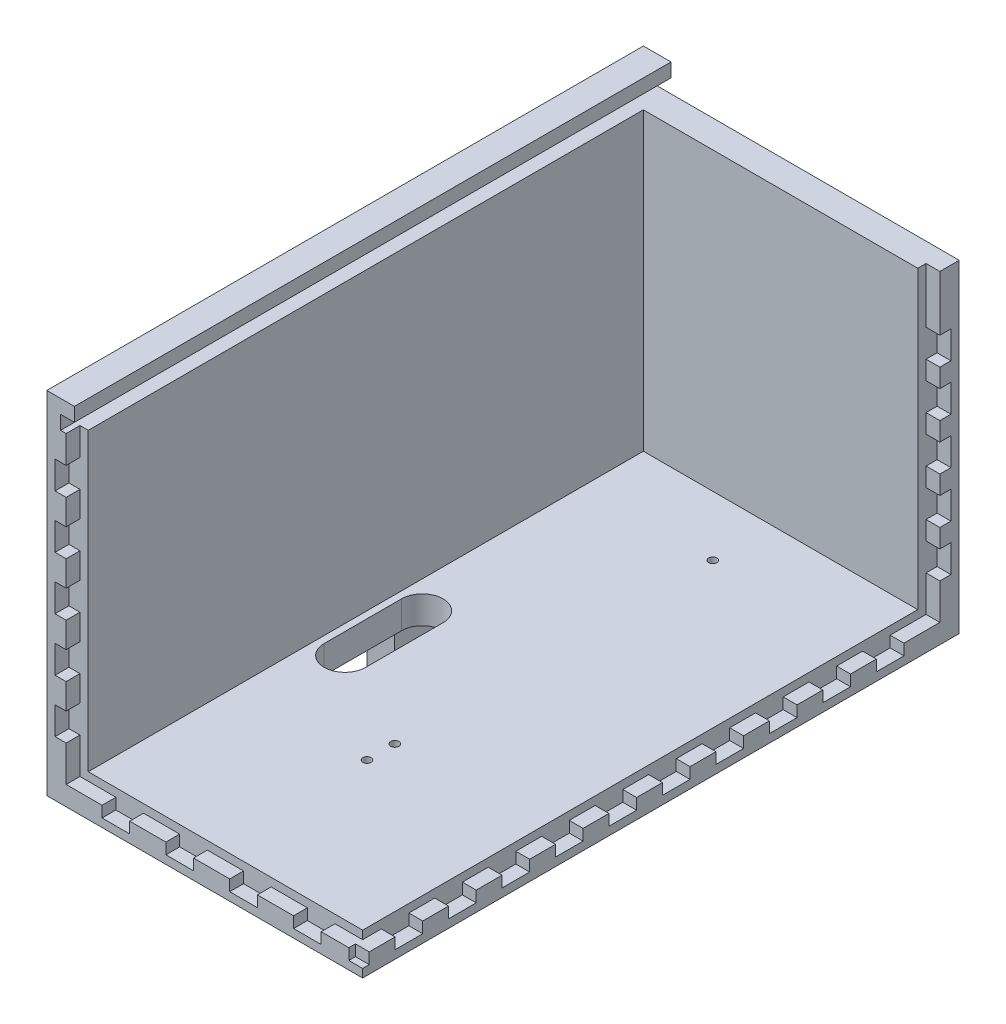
SolidWorks part; units mm, degrees
ref_plane "Front Plane" through (0, 0, 0) normal (0, 0, 1) x (1, 0, 0)
ref_plane "Top Plane" through (0, 0, 0) normal (0, 1, 0) x (1, 0, 0)
ref_plane "Right Plane" through (0, 0, 0) normal (1, 0, 0) x (0, 0, -1)
ref_plane "Metal_Det_Plane" through (0, 0, -5) normal (0, 0, -1) x (-1, 0, 0)
ref_plane "Center_Plane" through (0, 0, -215.9) normal (0, 0, -1) x (-1, 0, 0)
sketch "Centerline" plane through (0, 0, 0) normal (1, 0, 0) x (0, 0, -1)
  line L0 (-1000, 0) -> (49000, 0) construction
sketch "Sketch3" plane through (0, 0, 0) normal (1, 0, 0) x (0, 0, -1)
  line L3 (0, 0) -> (431.8, 0)
  line L4 (431.8, 0) -> (431.8, 127)
  line L5 (431.8, 127) -> (127, 127)
  line L6 (0, 0) -> (127, 127)
  point P3 (127, 0)
  point P4 (0, 0)
  dimension "D1" = 127
  dimension "D2" = 431.8
  dimension "D3" = 45
  dimension "D4" = 304.8
  dimension "D5" = 304.8
extrude "Boss-Extrude2" add sketch "Sketch3" along normal mid plane 228.6 contours L6 L5 L4 L3
shell "Shell2" thickness 10
sketch "Sketch4" plane through (0, 0, -431.8) normal (0, 0, -1) x (-1, 0, 0)
  line L0 (-104.3, 127) -> (-104.3, 122)
  line L1 (-114.3, 127) -> (114.3, 127) construction
  line L2 (-114.3, 127) -> (-114.3, 0) construction
  line L3 (-114.3, 0) -> (114.3, 0) construction
  line L4 (114.3, 127) -> (114.3, 0) construction
  line L5 (-114.3, 127) -> (114.3, 127) construction
  line L6 (-114.3, 127) -> (-114.3, 0) construction
  line L11 (-114.3, 0) -> (114.3, 0) construction
  line L13 (114.3, 127) -> (114.3, 0) construction
  line L14 (-114.3, 127) -> (114.3, 0) construction
  line L15 (-114.3, 0) -> (114.3, 127) construction
  line L16 (-104.3, 122) -> (-109.3, 122)
  line L17 (-109.3, 122) -> (-109.3, 117)
  line L18 (-109.3, 117) -> (-104.3, 117)
  line L19 (-104.3, 117) -> (-104.3, 10)
  line L20 (0, 0) -> (0, 127) construction
  line L21 (104.3, 10) -> (-104.3, 10)
  line L22 (104.3, 127) -> (104.3, 122)
  line L23 (104.3, 122) -> (109.3, 122)
  line L24 (109.3, 122) -> (109.3, 117)
  line L25 (109.3, 117) -> (104.3, 117)
  line L26 (104.3, 117) -> (104.3, 10)
  line L27 (-104.3, 117) -> (104.3, 117)
  line L28 (-104.3, 122) -> (104.3, 122)
  line L29 (-104.3, 127) -> (104.3, 127)
  point P8 (0, 63.5)
  point P20 (0, 63.5)
  point P24 (0, 10)
  dimension "D1" = 5
  dimension "D2" = 10
  dimension "D3" = 10
  dimension "D4" = 5
  dimension "D5" = 5
  dimension "D6" = 10
  dimension "D7" = 218.6
extrude "Cut-Extrude2" cut sketch "Sketch4" against normal blind 299.8 contours L27 L18 L17 L16 L28 L23 L24 L25
sketch "Sketch5" plane through (0, 0, -431.8) normal (0, 0, -1) x (-1, 0, 0)
  line L0 (-104.3, 122) -> (-104.3, 127)
  line L1 (-104.3, 127) -> (104.3, 127)
  line L2 (104.3, 127) -> (104.3, 122)
  line L3 (104.3, 122) -> (-104.3, 122)
extrude "Cut-Extrude3" cut sketch "Sketch5" against normal blind 10
ref_plane "Hardware_Surface Plane" through (0, 10, 0) normal (0, 1, 0) x (1, 0, 0)
sketch "Reference1 Base " plane through (0, 0, 0) normal (0, -1, 0) x (1, 0, 0)
  line L0 (76.2, 0) -> (-76.2, 0) construction
  line L1 (114.3, 0) -> (-114.3, 0) construction
  line L2 (-76.2, 0) -> (-76.2, -152.4) construction
  line L3 (-76.2, -152.4) -> (76.2, -152.4) construction
  line L4 (76.2, -152.4) -> (76.2, 0) construction
  line L5 (0, -69.85) -> (0, 69.85) construction
  circle A0 centre (-68.2, -144.4) radius 1.55
  circle A1 centre (-68.2, -8) radius 1.55
  circle A2 centre (68.2, -144.4) radius 1.55
  circle A3 centre (68.2, -8) radius 1.55
  point P6 (0, 0)
  dimension "D3" = 8
  dimension "D5" = 3.1
  dimension "D8" = 3.1
  dimension "D1" = 152.4
  dimension "D2" = 152.4
  dimension "D4" = 8
  dimension "D6" = 8
  dimension "D7" = 8
sketch "Reference2 Base" plane through (-114.3, 0, 0) normal (-1, 0, 0) x (0, 0, 1)
  line L0 (-10, 10) -> (-10, 0) construction
  line L1 (0, 0) -> (-127, 127) construction
  line L2 (-152.4, 0) -> (0, 0) construction
  dimension "D1" = 10
sketch "Reference3 Base" plane through (0, 0, 0) normal (0, 0.7071, 0.7071) x (1, 0, 0)
  line L0 (-114.3, 14.1421) -> (114.3, 14.1421) construction
  line L1 (114.3, 0) -> (114.3, 179.6051) construction
sketch "Base hole" plane through (0, 10, 0) normal (0, 1, 0) x (1, 0, 0)
  line L0 (-76.25, 10) -> (76.25, 10)
  line L1 (-76.25, 10) -> (-76.25, 162)
  line L2 (-76.25, 162) -> (76.25, 162)
  line L3 (76.25, 162) -> (76.25, 10)
  line L10 (-114.3, 10) -> (114.3, 10) construction
  line L12 (76.25, 162) -> (-76.25, 162) construction
  line L13 (76.25, 162) -> (76.25, 10) construction
  line L14 (76.25, 10) -> (-76.25, 10) construction
  line L15 (-76.25, 162) -> (-76.25, 10) construction
  line L16 (76.25, 162) -> (-76.25, 10) construction
  line L17 (76.25, 10) -> (-76.25, 162) construction
  point P3 (0, 10)
  point P6 (0, 86)
  dimension "D1" = 152.5
  dimension "D2" = 152
  dimension "D3" = 152
  dimension "D4" = 152.5
extrude "Cut-Extrude5" cut sketch "Base hole" along normal blind 10
sketch "Sketch16" plane through (0, 10, 0) normal (0, 1, 0) x (1, 0, 0)
  line L1 (-28.25, 114.25) -> (28.25, 114.25)
  line L2 (-28.25, 114.25) -> (-28.25, 57.75)
  line L3 (-28.25, 57.75) -> (28.25, 57.75)
  line L4 (28.25, 114.25) -> (28.25, 57.75)
  line L5 (-28.25, 114.25) -> (28.25, 57.75) construction
  line L6 (-28.25, 57.75) -> (28.25, 114.25) construction
  point P0 (0, 86)
  dimension "D1" = 56.5
  dimension "D2" = 56.5
extrude "Cut-Extrude7" cut sketch "Sketch16" along normal blind 120
sketch "Sketch17" plane through (0, 10, 0) normal (0, 1, 0) x (1, 0, 0)
  line L0 (-28.25, 57.75) -> (28.25, 57.75) construction
  line L1 (-28.25, 57.75) -> (28.25, 57.75)
  line L2 (-28.25, 57.75) -> (-28.25, 10)
  line L3 (-28.25, 10) -> (28.25, 10)
  line L4 (28.25, 57.75) -> (28.25, 10)
  line L6 (-28.25, 114.25) -> (-28.25, 57.75) construction
  line L7 (-114.3, 10) -> (114.3, 10) construction
  dimension "D1" = 56.5
extrude "Cut-Extrude8" cut sketch "Sketch17" along normal blind 120
ref_plane "Wall2 Plane" through (114.3, 0, 0) normal (1, 0, 0) x (0, 0, -1)
sketch "Sidewall_Motor_Tabs1" plane through (114.3, 0, 0) normal (1, 0, 0) x (0, 0, -1)
  line L0 (0, 0) -> (30, -30)
  line L1 (0, 0) -> (100, 0)
  line L3 (30, -30) -> (100, -30)
  line L4 (100, 0) -> (100, -30)
  line L5 (0, 0) -> (100, -30) construction
  line L6 (30, -30) -> (100, 0) construction
  line L8 (431.8, 0) -> (331.8, 0)
  line L9 (431.8, 0) -> (431.8, -30)
  line L10 (431.8, -30) -> (331.8, -30)
  line L11 (331.8, 0) -> (331.8, -30)
  line L12 (431.8, 0) -> (331.8, -30) construction
  line L13 (431.8, -30) -> (331.8, 0) construction
  point P4 (58.8235, -17.6471)
  point P13 (381.8, -15)
  dimension "D1" = 70
  dimension "D2" = 30
  dimension "D3" = 45
  dimension "D4" = 30
  dimension "D5" = 100
extrude "Motor_Mount_Wall1" add sketch "Sidewall_Motor_Tabs1" against normal blind 10
ref_plane "Wall1 Plane" through (-114.3, 0, 0) normal (-1, 0, 0) x (0, 0, 1)
sketch "Sidewall_Motor_Tabs2" plane through (-114.3, 0, 0) normal (-1, 0, 0) x (0, 0, 1)
  line L0 (0, 0) -> (-30, -30)
  line L1 (0, 0) -> (-100, 0)
  line L3 (-30, -30) -> (-100, -30)
  line L4 (-100, 0) -> (-100, -30)
  line L5 (0, 0) -> (-100, -30) construction
  line L6 (-30, -30) -> (-100, 0) construction
  line L8 (-431.8, 0) -> (-331.8, 0)
  line L9 (-431.8, 0) -> (-431.8, -30)
  line L10 (-431.8, -30) -> (-331.8, -30)
  line L11 (-331.8, 0) -> (-331.8, -30)
  line L12 (-431.8, 0) -> (-331.8, -30) construction
  line L13 (-431.8, -30) -> (-331.8, 0) construction
  point P4 (-58.8235, -17.6471)
  point P11 (-381.8, -15)
  dimension "D1" = 70
  dimension "D2" = 30
  dimension "D3" = 45
  dimension "D4" = 30
  dimension "D5" = 100
extrude "Motor_Mount_Wall2" add sketch "Sidewall_Motor_Tabs2" against normal blind 10
sketch "Side Wall Thickness Ref" plane through (-114.3, 0, 0) normal (-1, 0, 0) x (0, 0, 1)
  line L1 (-331.8, 0) -> (-100, 0) construction
  line L2 (-331.8, 0) -> (-331.8, 10) construction
  line L3 (-331.8, 10) -> (-100, 10) construction
  line L4 (-100, 0) -> (-100, 10) construction
  dimension "D1" = 10
sketch "Side Wall Thickness Ref1" plane through (0, 10, 0) normal (0, 1, 0) x (1, 0, 0)
  line L1 (-114.3, 331.8) -> (-104.3, 331.8) construction
  line L2 (-114.3, 331.8) -> (-114.3, 100) construction
  line L3 (-114.3, 100) -> (-104.3, 100) construction
  line L4 (-104.3, 331.8) -> (-104.3, 100) construction
  dimension "D1" = 10
sketch "Rear Slots" plane through (0, 10, 0) normal (0, 1, 0) x (1, 0, 0)
  line L0 (-94.3, 331.8) -> (-94.3, 303.8) construction
  line L1 (-86.8, 331.8) -> (-86.8, 303.8)
  line L2 (-101.8, 331.8) -> (-101.8, 303.8)
  line L3 (0, -69.85) -> (0, 69.85) construction
  line L4 (94.3, 331.8) -> (94.3, 303.8) construction
  line L5 (86.8, 331.8) -> (86.8, 303.8)
  line L6 (101.8, 331.8) -> (101.8, 303.8)
  arc A0 (-86.8, 331.8) -> (-101.8, 331.8) centre (-94.3, 331.8) ccw
  arc A1 (-101.8, 303.8) -> (-86.8, 303.8) centre (-94.3, 303.8) ccw
  arc A2 (86.8, 331.8) -> (101.8, 331.8) centre (94.3, 331.8) cw
  arc A3 (101.8, 303.8) -> (86.8, 303.8) centre (94.3, 303.8) cw
  point P2 (-94.3, 317.8)
  point P14 (94.3, 317.8)
  dimension "D2" = 28
  dimension "D1" = 15
  dimension "D3" = 10
extrude "Cut-Extrude_Rear Slots" cut sketch "Rear Slots" against normal blind 10
sketch "Front Slots" plane through (0, 10, 0) normal (0, 1, 0) x (1, 0, 0)
  line L0 (-94.3, 128) -> (-94.3, 100) construction
  line L1 (-86.8, 128) -> (-86.8, 100)
  line L2 (-101.8, 128) -> (-101.8, 100)
  line L3 (0, -69.85) -> (0, 69.85) construction
  line L4 (94.3, 128) -> (94.3, 100) construction
  line L5 (86.8, 128) -> (86.8, 100)
  line L6 (101.8, 128) -> (101.8, 100)
  arc A0 (-86.8, 128) -> (-101.8, 128) centre (-94.3, 128) ccw
  arc A1 (-101.8, 100) -> (-86.8, 100) centre (-94.3, 100) ccw
  arc A2 (86.8, 128) -> (101.8, 128) centre (94.3, 128) cw
  arc A3 (101.8, 100) -> (86.8, 100) centre (94.3, 100) cw
  point P2 (-94.3, 114)
  point P12 (94.3, 114)
  dimension "D1" = 15
  dimension "D2" = 28
  dimension "D3" = 10
extrude "Cut-Extrude_Front Slots" cut sketch "Front Slots" against normal blind 10
sketch "Sketch25" plane through (-114.3, 0, 0) normal (-1, 0, 0) x (0, 0, 1)
  line L0 (-331.8, -26.15) -> (-331.8, -3.85) construction
  line L1 (-331.8, 0) -> (-331.8, -30) construction
  line L2 (-331.8, -3.85) -> (-396.2, -3.85) construction
  line L3 (-396.2, -3.85) -> (-396.2, -26.15) construction
  line L4 (-396.2, -26.15) -> (-332.748, -26.15) construction
  line L5 (-331.8, -15) -> (-385.2, -15) construction
  line L6 (-365.1, -6.25) -> (-365.1, -23.75) construction
  line L7 (-215.9, 86.35) -> (-215.9, -86.35) construction
  line L8 (-66.7, -6.25) -> (-66.7, -23.75) construction
  line L9 (-100, -15) -> (-46.6, -15) construction
  line L10 (-35.6, -26.15) -> (-99.052, -26.15) construction
  line L11 (-35.6, -3.85) -> (-35.6, -26.15) construction
  line L12 (-100, -3.85) -> (-35.6, -3.85) construction
  line L13 (-100, -26.15) -> (-100, -3.85) construction
  circle A0 centre (-385.2, -15) radius 3
  circle A1 centre (-365.1, -6.25) radius 1.55
  circle A2 centre (-365.1, -23.75) radius 1.55
  circle A3 centre (-66.7, -23.75) radius 1.55
  circle A4 centre (-66.7, -6.25) radius 1.55
  circle A5 centre (-46.6, -15) radius 3
  point P5 (-331.8, -15)
  point P15 (-365.1, -15)
  point P31 (-66.7, -15)
  point P32 (-100, -15)
  dimension "D4" = 6
  dimension "D7" = 3.1
  dimension "D8" = 3.1
  dimension "D1" = 22.3
  dimension "D2" = 64.4
  dimension "D3" = 53.4
  dimension "D5" = 20.1
  dimension "D6" = 17.5
extrude "Motor_Holes" cut sketch "Sketch25" against normal through all
extrude "Cut-Extrude9" cut sketch "Reference1 Base " against normal blind 10
sketch "Sketch26" plane through (0, 0, 0) normal (0, -1, 0) x (1, 0, 0)
  line L0 (-76.2, -152.4) -> (76.2, -152.4) construction
  line L1 (-60.08, -157.4) -> (60.08, -157.4) construction
  line L2 (-60.08, -157.4) -> (-60.08, -277.56) construction
  line L3 (-60.08, -277.56) -> (60.08, -277.56) construction
  line L4 (60.08, -157.4) -> (60.08, -277.56) construction
  line L5 (-60.08, -157.4) -> (60.08, -277.56) construction
  line L6 (-60.08, -277.56) -> (60.08, -157.4) construction
  line L7 (-60.08, -282.56) -> (60.08, -282.56) construction
  line L8 (-60.08, -282.56) -> (-60.08, -402.72) construction
  line L11 (-60.08, -402.72) -> (60.08, -402.72) construction
  line L13 (0, -86.35) -> (0, 86.35) construction
  line L14 (60.08, -282.56) -> (60.08, -402.72) construction
  line L15 (-60.08, -282.56) -> (60.08, -402.72) construction
  line L16 (-60.08, -402.72) -> (60.08, -282.56) construction
  circle A0 centre (-57.54, -159.94) radius 1.5
  circle A1 centre (57.54, -159.94) radius 1.5
  circle A2 centre (-57.54, -275.02) radius 1.5
  circle A3 centre (57.54, -275.02) radius 1.5
  circle A4 centre (-57.54, -285.1) radius 1.5
  circle A6 centre (-57.54, -400.18) radius 1.5
  circle A8 centre (57.54, -285.1) radius 1.5
  circle A9 centre (57.54, -400.18) radius 1.5
  point P4 (0, -217.48)
  point P23 (0, -342.64)
  dimension "D7" = 3
  dimension "D10" = 2.54
  dimension "D12" = 3
  dimension "D13" = 3
  dimension "D4" = 120.16
  dimension "D17" = 3
  dimension "D1" = 120.16
  dimension "D2" = 120.16
  dimension "D3" = 5
  dimension "D5" = 120.16
  dimension "D6" = 2.54
  dimension "D8" = 2.54
  dimension "D9" = 2.54
  dimension "D11" = 2.54
  dimension "D14" = 2.54
  dimension "D15" = 2.54
  dimension "D16" = 2.54
  dimension "D18" = 5
extrude "Cut-Extrude_TowerBase_Holes" cut sketch "Sketch26" against normal blind 10
sketch "Sketch27" plane through (0, 0, 0) normal (1, 0, 0) x (0, 0, -1)
  line L0 (431.8, -30) -> (331.8, -30) construction
  line L1 (431.8, 127) -> (0, 127)
  line L2 (431.8, 127) -> (431.8, -30)
  line L3 (431.8, -30) -> (0, -30)
  line L4 (0, 127) -> (0, -30)
extrude "Cut-Extrude10" cut sketch "Sketch27" along normal through all
sketch "Sketch28" plane through (0, 0, 0) normal (1, 0, 0) x (0, 0, -1)
  line L0 (421.8, 10) -> (10, 10) construction
  line L1 (24.1421, 10) -> (421.8, 10)
  line L2 (24.1421, 10) -> (24.1421, 7)
  line L3 (24.1421, 7) -> (424.8, 7)
  line L6 (421.8, 117) -> (424.8, 117)
  line L7 (421.8, 117) -> (421.8, 10)
  line L9 (424.8, 117) -> (424.8, 7)
  dimension "D1" = 3
  dimension "D2" = 3
extrude "Cut-Extrude11" cut sketch "Sketch28" against normal blind 5 contours L6 L9 L3 L2 L1 L7
sketch "Sketch31" plane through (0, 0, 0) normal (1, 0, 0) x (0, 0, -1)
  line L6 (424.8, 20) -> (428.8, 20)
  line L84 (401.8, 7) -> (411.8, 7)
  line L85 (401.8, 7) -> (401.8, 3)
  line L86 (401.8, 3) -> (411.8, 3)
  line L87 (411.8, 7) -> (411.8, 3)
  line L89 (431.8, 0) -> (0, 0) construction
  line L90 (382.4496, 7) -> (382.4496, 3)
  line L91 (382.4496, 7) -> (392.4496, 7)
  line L92 (392.4496, 7) -> (392.4496, 3)
  line L93 (382.4496, 3) -> (392.4496, 3)
  line L94 (363.0992, 7) -> (363.0992, 3)
  line L95 (363.0992, 7) -> (373.0992, 7)
  line L96 (373.0992, 7) -> (373.0992, 3)
  line L97 (363.0992, 3) -> (373.0992, 3)
  line L98 (343.7488, 7) -> (343.7488, 3)
  line L99 (343.7488, 7) -> (353.7488, 7)
  line L100 (353.7488, 7) -> (353.7488, 3)
  line L101 (343.7488, 3) -> (353.7488, 3)
  line L102 (324.3983, 7) -> (324.3983, 3)
  line L103 (324.3983, 7) -> (334.3983, 7)
  line L104 (334.3983, 7) -> (334.3983, 3)
  line L105 (324.3983, 3) -> (334.3983, 3)
  line L106 (305.0479, 7) -> (305.0479, 3)
  line L107 (305.0479, 7) -> (315.0479, 7)
  line L108 (315.0479, 7) -> (315.0479, 3)
  line L109 (305.0479, 3) -> (315.0479, 3)
  line L110 (285.6975, 7) -> (285.6975, 3)
  line L111 (285.6975, 7) -> (295.6975, 7)
  line L112 (295.6975, 7) -> (295.6975, 3)
  line L113 (285.6975, 3) -> (295.6975, 3)
  line L114 (266.3471, 7) -> (266.3471, 3)
  line L115 (266.3471, 7) -> (276.3471, 7)
  line L116 (276.3471, 7) -> (276.3471, 3)
  line L117 (266.3471, 3) -> (276.3471, 3)
  line L118 (246.9967, 7) -> (246.9967, 3)
  line L119 (246.9967, 7) -> (256.9967, 7)
  line L120 (256.9967, 7) -> (256.9967, 3)
  line L121 (246.9967, 3) -> (256.9967, 3)
  line L122 (227.6463, 7) -> (227.6463, 3)
  line L123 (227.6463, 7) -> (237.6463, 7)
  line L124 (237.6463, 7) -> (237.6463, 3)
  line L125 (227.6463, 3) -> (237.6463, 3)
  line L126 (208.2959, 7) -> (208.2959, 3)
  line L127 (208.2959, 7) -> (218.2959, 7)
  line L128 (218.2959, 7) -> (218.2959, 3)
  line L129 (208.2959, 3) -> (218.2959, 3)
  line L130 (188.9454, 7) -> (188.9454, 3)
  line L131 (188.9454, 7) -> (198.9454, 7)
  line L132 (198.9454, 7) -> (198.9454, 3)
  line L133 (188.9454, 3) -> (198.9454, 3)
  line L134 (169.595, 7) -> (169.595, 3)
  line L135 (169.595, 7) -> (179.595, 7)
  line L136 (179.595, 7) -> (179.595, 3)
  line L137 (169.595, 3) -> (179.595, 3)
  line L138 (150.2446, 7) -> (150.2446, 3)
  line L139 (150.2446, 7) -> (160.2446, 7)
  line L140 (160.2446, 7) -> (160.2446, 3)
  line L141 (150.2446, 3) -> (160.2446, 3)
  line L142 (130.8942, 7) -> (130.8942, 3)
  line L143 (130.8942, 7) -> (140.8942, 7)
  line L144 (140.8942, 7) -> (140.8942, 3)
  line L145 (130.8942, 3) -> (140.8942, 3)
  line L146 (111.5438, 7) -> (111.5438, 3)
  line L147 (111.5438, 7) -> (121.5438, 7)
  line L148 (121.5438, 7) -> (121.5438, 3)
  line L149 (111.5438, 3) -> (121.5438, 3)
  line L150 (92.1934, 7) -> (92.1934, 3)
  line L151 (92.1934, 7) -> (102.1934, 7)
  line L152 (102.1934, 7) -> (102.1934, 3)
  line L153 (92.1934, 3) -> (102.1934, 3)
  line L154 (72.843, 7) -> (72.843, 3)
  line L155 (72.843, 7) -> (82.843, 7)
  line L156 (82.843, 7) -> (82.843, 3)
  line L157 (72.843, 3) -> (82.843, 3)
  line L158 (53.4925, 7) -> (53.4925, 3)
  line L159 (53.4925, 7) -> (63.4925, 7)
  line L160 (63.4925, 7) -> (63.4925, 3)
  line L161 (53.4925, 3) -> (63.4925, 3)
  line L162 (34.1421, 7) -> (34.1421, 3)
  line L163 (34.1421, 7) -> (44.1421, 7)
  line L164 (44.1421, 7) -> (44.1421, 3)
  line L165 (34.1421, 3) -> (44.1421, 3)
  line L166 (424.8, 20) -> (424.8, 30)
  line L167 (424.8, 30) -> (428.8, 30)
  line L168 (428.8, 20) -> (428.8, 30)
  line L169 (431.8, 0) -> (431.8, 117) construction
  line L170 (424.8, 36.75) -> (424.8, 46.75)
  line L171 (424.8, 36.75) -> (428.8, 36.75)
  line L172 (428.8, 36.75) -> (428.8, 46.75)
  line L173 (424.8, 46.75) -> (428.8, 46.75)
  line L174 (424.8, 53.5) -> (424.8, 63.5)
  line L175 (424.8, 53.5) -> (428.8, 53.5)
  line L176 (428.8, 53.5) -> (428.8, 63.5)
  line L177 (424.8, 63.5) -> (428.8, 63.5)
  line L178 (424.8, 70.25) -> (424.8, 80.25)
  line L179 (424.8, 70.25) -> (428.8, 70.25)
  line L180 (428.8, 70.25) -> (428.8, 80.25)
  line L181 (424.8, 80.25) -> (428.8, 80.25)
  line L182 (424.8, 87) -> (424.8, 97)
  line L183 (424.8, 87) -> (428.8, 87)
  line L184 (428.8, 87) -> (428.8, 97)
  line L185 (424.8, 97) -> (428.8, 97)
  line L186 (424.8, 117) -> (431.8, 117) construction
  line L189 (24.1421, 7) -> (424.8, 7) construction
  line L190 (421.8, 117) -> (421.8, 10) construction
  line L191 (24.1421, 10) -> (421.8, 10) construction
  line L192 (424.8, 117) -> (424.8, 7) construction
  dimension "D2" = 10
  dimension "D4" = 20
  dimension "D5" = 10
  dimension "D3" = 3
  dimension "D6" = 10
  dimension "D7" = 10
  dimension "D8" = 3
  dimension "D10" = 20
  dimension "D11" = 10
  dimension "D9" = 5
extrude "Cut-Extrude12" cut sketch "Sketch31" against normal blind 5 contours L85 L84 L87 L86 | L178 L181 L180 L179 | L174 L177 L176 L175 | L170 L173 L172 L171 | L166 L6 L168 L167 | L90 L93 L92 L91 | L98 L101 L100 L99 | L102 L105 L104 L103 | L94 L97 L96 L95 | L106 L109 L108 L107 | L110 L113 L112 L111 | L114 L117 L116 L115 | L118 L121 L120 L119 | L122 L125 L124 L123 | L126 L129 L128 L127 | L130 L133 L132 L131 | L134 L137 L136 L135 | L138 L141 L140 L139 | L142 L145 L144 L143 | L146 L149 L148 L147 | L150 L153 L152 L151 | L154 L157 L156 L155 | L158 L161 L160 L159 | L162 L165 L164 L163 | L182 L185 L184 L183
sketch "Sketch32" plane through (-114.3, 0, 0) normal (-1, 0, 0) x (0, 0, 1)
  line L0 (0, 0) -> (-431.8, 0) construction
  line L1 (-215.9, 0) -> (-215.9, 127) construction
  line L2 (-431.8, 127) -> (-127, 127) construction
  point P4 (-215.9, 0)
ref_plane "Plane1" through (0, 0, -215.9) normal (0, 0, 1) x (1, 0, 0)
sketch "Sketch33" plane through (0, 0, -215.9) normal (0, 0, 1) x (1, 0, 0)
  line L0 (-104.3, -30) -> (-114.3, -30) construction
  line L1 (-114.3, 127) -> (0, 127)
  line L2 (-114.3, 127) -> (-114.3, -30)
  line L3 (-114.3, -30) -> (0, -30)
  line L4 (0, 127) -> (0, -30)
  line L5 (0, 127) -> (0, 114.25) construction
extrude "Cut-Extrude13" cut sketch "Sketch33" along normal through all
sketch "Sketch34" plane through (0, 0, -215.9) normal (0, 0, 1) x (1, 0, 0)
  line L0 (-5, 10) -> (-104.3, 10) construction
  line L1 (-104.3, 117) -> (-107.3, 117)
  line L2 (-104.3, 117) -> (-104.3, 10)
  line L4 (-107.3, 117) -> (-107.3, 7)
  line L6 (-5, 10) -> (-5, 7)
  line L7 (-5, 7) -> (-107.3, 7)
  line L9 (-5, 10) -> (-104.3, 10)
  point P1 (-107.3, 6.8702)
  point P2 (-104.3, 10)
  dimension "D1" = 3
  dimension "D2" = 3
extrude "Cut-Extrude14" cut sketch "Sketch34" against normal blind 5
sketch "Sketch35" plane through (0, 0, -215.9) normal (0, 0, 1) x (1, 0, 0)
  line L0 (-107.3, 7) -> (-5, 7) construction
  line L1 (-94.3, 7) -> (-84.3, 7)
  line L2 (-94.3, 7) -> (-94.3, 3)
  line L3 (-94.3, 3) -> (-84.3, 3)
  line L4 (-84.3, 7) -> (-84.3, 3)
  line L5 (-114.3, 0) -> (0, 0) construction
  line L6 (-71.2, 7) -> (-71.2, 3)
  line L7 (-71.2, 7) -> (-61.2, 7)
  line L8 (-61.2, 7) -> (-61.2, 3)
  line L9 (-71.2, 3) -> (-61.2, 3)
  line L10 (-48.1, 7) -> (-48.1, 3)
  line L11 (-48.1, 7) -> (-38.1, 7)
  line L12 (-38.1, 7) -> (-38.1, 3)
  line L13 (-48.1, 3) -> (-38.1, 3)
  line L14 (-25, 7) -> (-25, 3)
  line L15 (-25, 7) -> (-15, 7)
  line L16 (-15, 7) -> (-15, 3)
  line L17 (-25, 3) -> (-15, 3)
  line L18 (-107.3, 117) -> (-107.3, 7) construction
  line L19 (-107.3, 20) -> (-111.3, 20)
  line L20 (-107.3, 20) -> (-107.3, 30)
  line L21 (-107.3, 30) -> (-111.3, 30)
  line L22 (-111.3, 20) -> (-111.3, 30)
  line L23 (-5, 10) -> (-104.3, 10) construction
  line L24 (-114.3, 0) -> (-114.3, 127) construction
  line L25 (-107.3, 39.25) -> (-107.3, 49.25)
  line L26 (-107.3, 39.25) -> (-111.3, 39.25)
  line L27 (-111.3, 39.25) -> (-111.3, 49.25)
  line L28 (-107.3, 49.25) -> (-111.3, 49.25)
  line L29 (-107.3, 58.5) -> (-107.3, 68.5)
  line L30 (-107.3, 58.5) -> (-111.3, 58.5)
  line L31 (-111.3, 58.5) -> (-111.3, 68.5)
  line L32 (-107.3, 68.5) -> (-111.3, 68.5)
  line L33 (-107.3, 77.75) -> (-107.3, 87.75)
  line L34 (-107.3, 77.75) -> (-111.3, 77.75)
  line L35 (-111.3, 77.75) -> (-111.3, 87.75)
  line L36 (-107.3, 87.75) -> (-111.3, 87.75)
  line L37 (-107.3, 97) -> (-107.3, 107)
  line L38 (-107.3, 97) -> (-111.3, 97)
  line L39 (-111.3, 97) -> (-111.3, 107)
  line L40 (-107.3, 107) -> (-111.3, 107)
  line L41 (-107.3, 117) -> (-109.3, 117) construction
  dimension "D1" = 3
  dimension "D2" = 10
  dimension "D3" = 10
  dimension "D5" = 10
  dimension "D6" = 10
  dimension "D7" = 10
  dimension "D8" = 3
  dimension "D10" = 10
  dimension "D4" = 4
  dimension "D9" = 5
extrude "Cut-Extrude15" cut sketch "Sketch35" against normal blind 5
